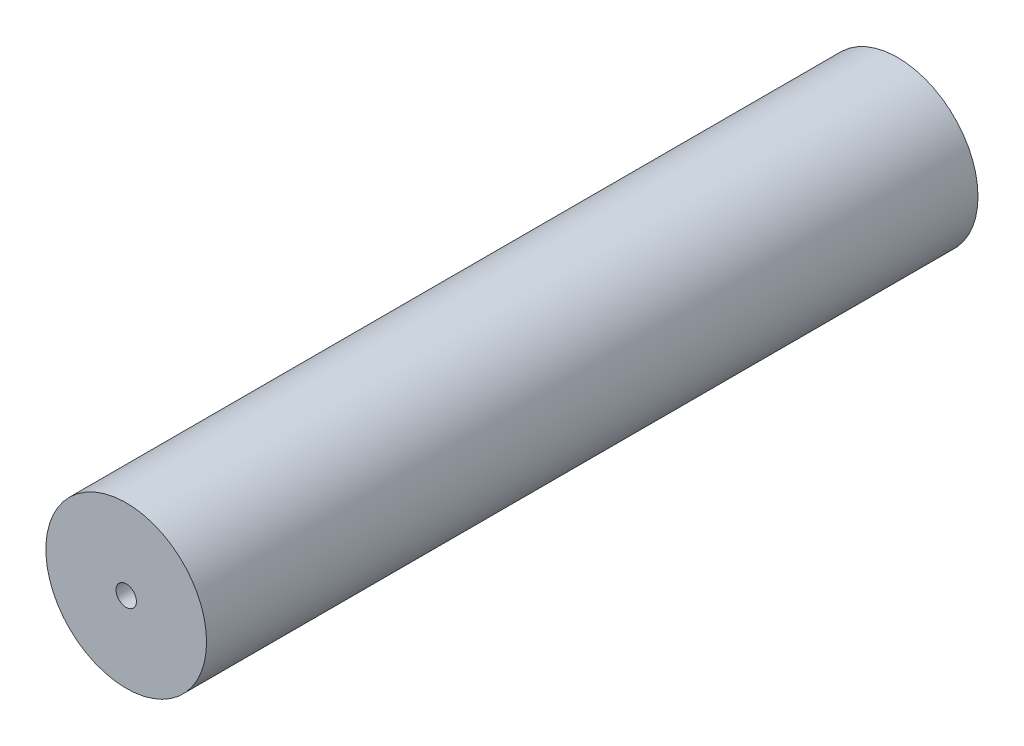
SolidWorks part; units mm, degrees
ref_plane "Front Plane" through (0, 0, 0) normal (0, 0, 1) x (1, 0, 0)
ref_plane "Top Plane" through (0, 0, 0) normal (0, 1, 0) x (1, 0, 0)
ref_plane "Right Plane" through (0, 0, 0) normal (1, 0, 0) x (0, 0, -1)
sketch "Sketch1" plane through (0, 0, 0) normal (0, 0, 1) x (1, 0, 0)
  arc A1 (15.575, 33.4125) -> (15.575, 8.4125) centre (15.575, 20.9125) ccw
  circle A2 centre (15.575, 20.9125) radius 12.5
  circle A3 centre (15.575, 20.9125) radius 1.5875
  dimension "D1" = 3.175
extrude "Boss-Extrude1" add sketch "Sketch1" against normal blind 120 contours A1 A2
